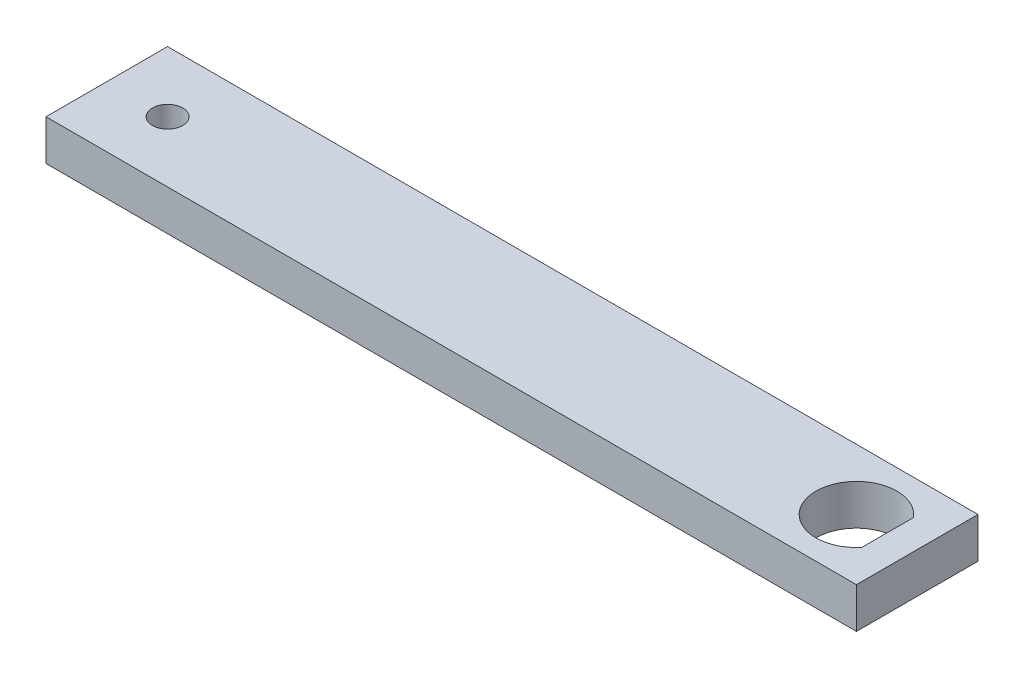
SolidWorks part; units mm, degrees
ref_plane "Front" through (0, 0, 0) normal (0, 0, 1) x (1, 0, 0)
ref_plane "Top" through (0, 0, 0) normal (0, 1, 0) x (-1, 0, 0)
ref_plane "Right" through (0, 0, 0) normal (1, 0, 0) x (0, 0, -1)
sketch "Sketch1" plane through (0, 0, 0) normal (0, 0, 1) x (1, 0, 0)
  line L0 (0, 0) -> (127, 0)
  line L1 (0, 0) -> (0, 6.35)
  line L2 (127, 6.35) -> (0, 6.35)
  line L3 (127, 6.35) -> (127, 0)
  dimension "D1" = 6.35
  dimension "D2" = 127
extrude "Base-Extrude" add sketch "Sketch1" along normal blind 19.05
sketch "Sketch2" plane through (0, 6.35, 0) normal (0, 1, 0) x (-1, 0, 0)
  line L0 (-127, 19.05) -> (-127, 0) construction
  line L1 (-127, 19.05) -> (0, 19.05) construction
  line L2 (-122.3645, 5.4734) -> (-122.3645, 13.5766)
  arc A0 (-122.3645, 5.4734) -> (-122.3645, 13.5766) centre (-117.475, 9.525) ccw
  dimension "D1" = 12.7
  dimension "D2" = 9.525
  dimension "D3" = 9.525
  dimension "D4" = 4.8895
extrude "Cut-Extrude1" cut sketch "Sketch2" against normal through all
sketch "Sketch3" plane through (0, 6.35, 0) normal (0, 1, 0) x (-1, 0, 0)
  line L0 (0, 19.05) -> (0, 0) construction
  circle A0 centre (-9.525, 9.525) radius 2.3813
  arc A1 (-122.3645, 5.4734) -> (-122.3645, 13.5766) centre (-117.475, 9.525) ccw construction
  point P5 (-117.475, 9.525)
  dimension "D1" = 4.7625
  dimension "D2" = 9.525
extrude "Cut-Extrude2" cut sketch "Sketch3" against normal through all
